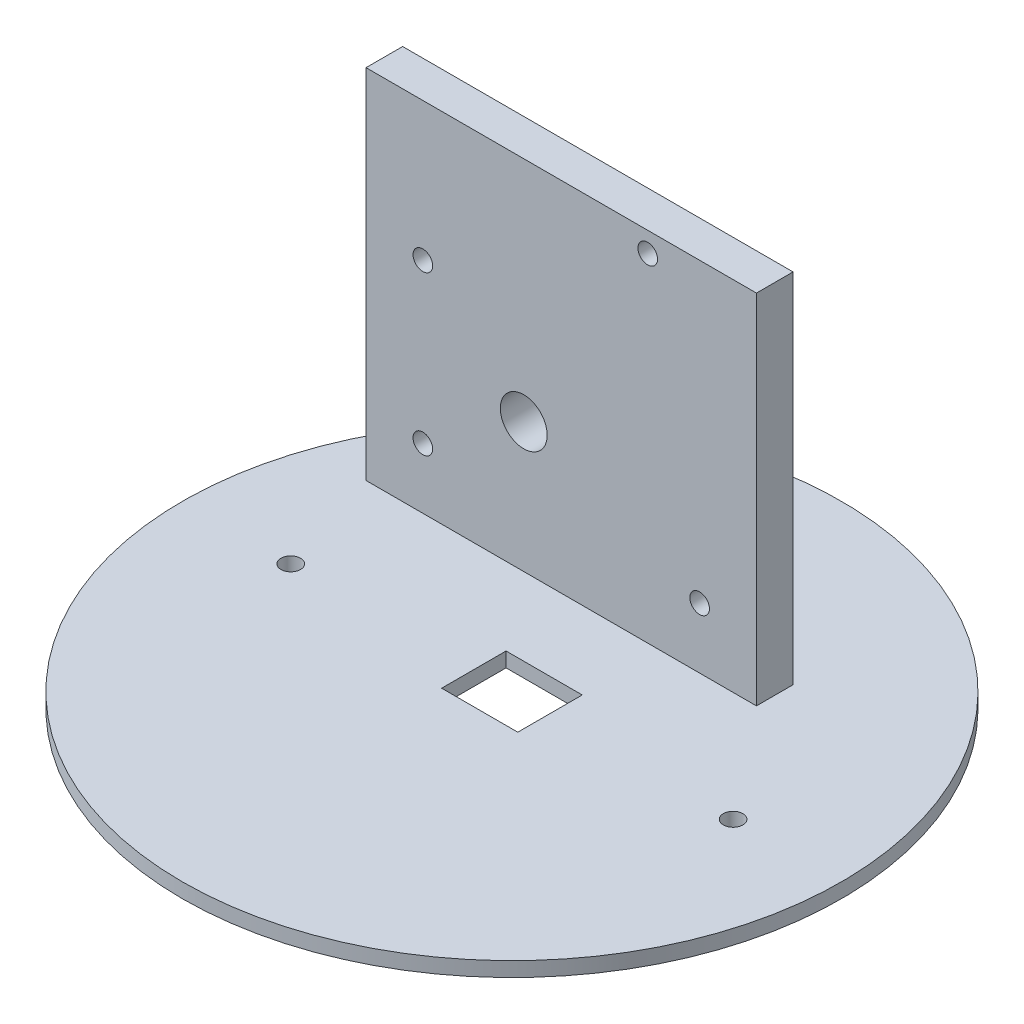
SolidWorks part; units mm, degrees
ref_plane "Front Plane" through (0, 0, 0) normal (0, 0, 1) x (1, 0, 0)
ref_plane "Top Plane" through (0, 0, 0) normal (0, 1, 0) x (1, 0, 0)
ref_plane "Right Plane" through (0, 0, 0) normal (1, 0, 0) x (0, 0, -1)
sketch "Sketch3" plane through (0, 0, 0) normal (0, 1, 0) x (1, 0, 0)
  circle A0 centre (0, 0) radius 57.15
  dimension "D1" = 114.3
extrude "Boss-Extrude1" add sketch "Sketch3" along normal blind 2.54
sketch "Sketch4" plane through (0, 2.54, 0) normal (0, 1, 0) x (1, 0, 0)
  line L1 (-6.604, 5.588) -> (6.604, 5.588)
  line L2 (-6.604, 5.588) -> (-6.604, -5.588)
  line L3 (-6.604, -5.588) -> (6.604, -5.588)
  line L4 (6.604, 5.588) -> (6.604, -5.588)
  line L5 (-6.604, 5.588) -> (6.604, -5.588) construction
  line L6 (-6.604, -5.588) -> (6.604, 5.588) construction
  point P0 (0, 0)
  dimension "D1" = 11.176
  dimension "D2" = 13.208
extrude "Cut-Extrude1" cut sketch "Sketch4" against normal through all
sketch "Sketch5" plane through (0, 2.54, 0) normal (0, 1, 0) x (1, 0, 0)
  line L0 (-6.604, 5.588) -> (-6.604, -5.588) construction
  line L1 (-44.3499, 25.4) -> (23.35, 25.4)
  line L2 (-44.3499, 25.4) -> (-44.3499, 19.05)
  line L3 (-44.3499, 19.05) -> (23.35, 19.05)
  line L4 (23.35, 25.4) -> (23.35, 19.05)
  line L5 (-44.3499, 25.4) -> (23.35, 19.05) construction
  line L6 (-44.3499, 19.05) -> (23.35, 25.4) construction
  point P0 (-10.5, 22.225)
  point P5 (0, 0)
  point P9 (0, 0)
  dimension "D1" = 37.7459
  dimension "D2" = 19.05
  dimension "D3" = 6.35
  dimension "D4" = 23.35
extrude "Boss-Extrude2" add sketch "Sketch5" along normal blind 61.9989
hole_wizard "M3 Clearance Hole1" positions "Sketch6" profile "Sketch7" hole size "M3" standard "ANSI Metric"
sketch "Sketch6" plane through (0, 2.54, 0) normal (0, 1, 0) x (1, 0, 0)
  line L0 (0, 0) -> (0, -20.1994) construction
  point P0 (38.354, 0)
  point P2 (-38.354, 0)
  dimension "D1" = 38.354
sketch "Sketch7" plane through (38.354, 2.54, 0) normal (1, 0, 0) x (0, 0, 1)
  line L0 (0, 0) -> (0, 2.54)
  line L1 (0, 2.54) -> (1.725, 2.54)
  line L2 (1.7, 2.515) -> (1.7, 0)
  line L5 (1.7, 0) -> (0, 0)
  line L7 (1.725, 2.54) -> (1.7, 2.515)
  line L8 (-1.725, 2.54) -> (-1.7, 2.515) construction
  line L11 (0, -6.35) -> (0, 107.95) construction
  dimension "Thru Hole Dia." = 3.4
  dimension "Thru Hole Depth" = 2.54
  dimension "Far C'Sink Dia." = 3.45
  dimension "Far C'Sink Angle" = 90
sketch "Sketch8" plane through (0, 0, -25.4) normal (0, 0, -1) x (-1, 0, 0)
  line L0 (-23.35, 2.54) -> (44.3499, 2.54) construction
  line L1 (44.3499, 64.5389) -> (44.3499, 2.54) construction
  circle A0 centre (17, 25.04) radius 4.064
  dimension "D2" = 8.128
  dimension "D3" = 27.35
  dimension "D1" = 22.5
extrude "Cut-Extrude2" cut sketch "Sketch8" against normal through all
hole_wizard "M3 Clearance Hole2" positions "Sketch12" profile "Sketch13" hole size "M3" standard "ANSI Metric"
sketch "Sketch12" plane through (0, 0, -19.05) normal (0, 0, 1) x (1, 0, 0)
  line L0 (-44.3499, 2.54) -> (23.35, 2.54) construction
  line L1 (23.35, 64.5389) -> (23.35, 2.54) construction
  line L2 (-10.5, 64.5389) -> (-10.5, 6.5255) construction
  line L3 (-44.3499, 64.5389) -> (23.35, 64.5389) construction
  point P0 (-34.4999, 13.04)
  point P2 (-34.4999, 40.54)
  point P4 (4.5, 61.0389)
  point P6 (13.5, 13.04)
  point P21 (0, 0)
  dimension "D1" = 27.5
  dimension "D2" = 10.5
  dimension "D3" = 9.85
  dimension "D4" = 18.85
  dimension "D5" = 3.5
sketch "Sketch13" plane through (-34.4999, 13.04, -19.05) normal (1, 0, 0) x (0, -1, 0)
  line L0 (0, 0) -> (0, 6.35)
  line L1 (0, 6.35) -> (1.725, 6.35)
  line L2 (1.7, 6.325) -> (1.7, 0)
  line L5 (1.7, 0) -> (0, 0)
  line L7 (1.725, 6.35) -> (1.7, 6.325)
  line L8 (-1.725, 6.35) -> (-1.7, 6.325) construction
  line L11 (0, -6.35) -> (0, 107.95) construction
  dimension "Thru Hole Dia." = 3.4
  dimension "Thru Hole Depth" = 6.35
  dimension "Far C'Sink Dia." = 3.45
  dimension "Far C'Sink Angle" = 90
